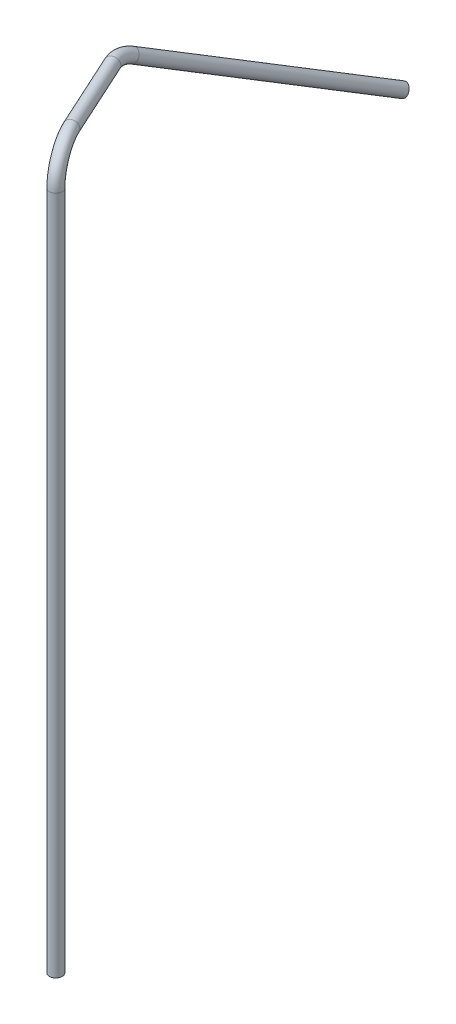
SolidWorks part; units mm, degrees
ref_plane "Plan de face" through (0, 0, 0) normal (0, 0, 1) x (1, 0, 0)
ref_plane "Plan de dessus" through (0, 0, 0) normal (0, 1, 0) x (1, 0, 0)
ref_plane "Plan de droite" through (0, 0, 0) normal (1, 0, 0) x (0, 0, -1)
sketch3d "Esquisse3D1"
  line L0 (0, -15, 0) -> (0, -335, 0)
  line L1 (-6.2364, 0, -13.6421) -> (-22.4512, 0, -49.1116)
  line L2 (0, -335, 0) -> (0, 159.7515, 0) construction
  line L3 (-25.0344, 0, -54.7623) -> (-25.0344, -152.5148, -54.7623) construction
  line L4 (0, -15, 0) -> (-25.0344, -41.8604, -54.7623) construction
  line L5 (-23.7918, -2.8131, -60.161) -> (0.0065, -56.6921, -163.5617)
  arc A0 (-6.2364, 0, -13.6421) -> (0, -15, 0) centre (-6.2364, -15, -13.6421) ccw
  arc A1 (-23.7918, -2.8131, -60.161) -> (-22.4512, 0, -49.1116) centre (-11.9724, -9.6046, -53.9019) ccw
  point P6 (0, 0, 0)
  point P7 (7.4057, -15, -19.8785)
  point P13 (-25.0344, 0, -54.7623)
  point P16 (-3.2373, 1.9172, -57.8951)
  dimension "D1" = 90
  dimension "D5" = 15
  dimension "D7" = 15
  dimension "D2" = 320
  dimension "D4" = 39
  dimension "D3" = 225
  dimension "D6" = 119
ref_plane "Plan1" through (0, -335, 0) normal (0, 1, 0) x (1, 0, 0)
sketch "Esquisse1" plane through (0, -335, 0) normal (0, 1, 0) x (1, 0, 0)
  circle A0 centre (0, 0) radius 3
  point P3 (-3, 0)
  dimension "D1" = 6
sweep "Balayage1" add profiles "Esquisse1" path "Esquisse3D1"
sketch "Esquisse2" plane through (33.5557, -75.9696, -145.7952) normal (0.2, -0.4528, -0.8689) x (0.9797, 0.0776, 0.1851)
  circle A0 centre (-34.6596, -24.7291) radius 3 construction
  point P0 (-34.7654, -27.7272)
ref_plane "Plan2" through (-2.7284, 0, 1.2473) normal (-0.9095, 0, 0.4158) x (0.4158, 0, 0.9095)
